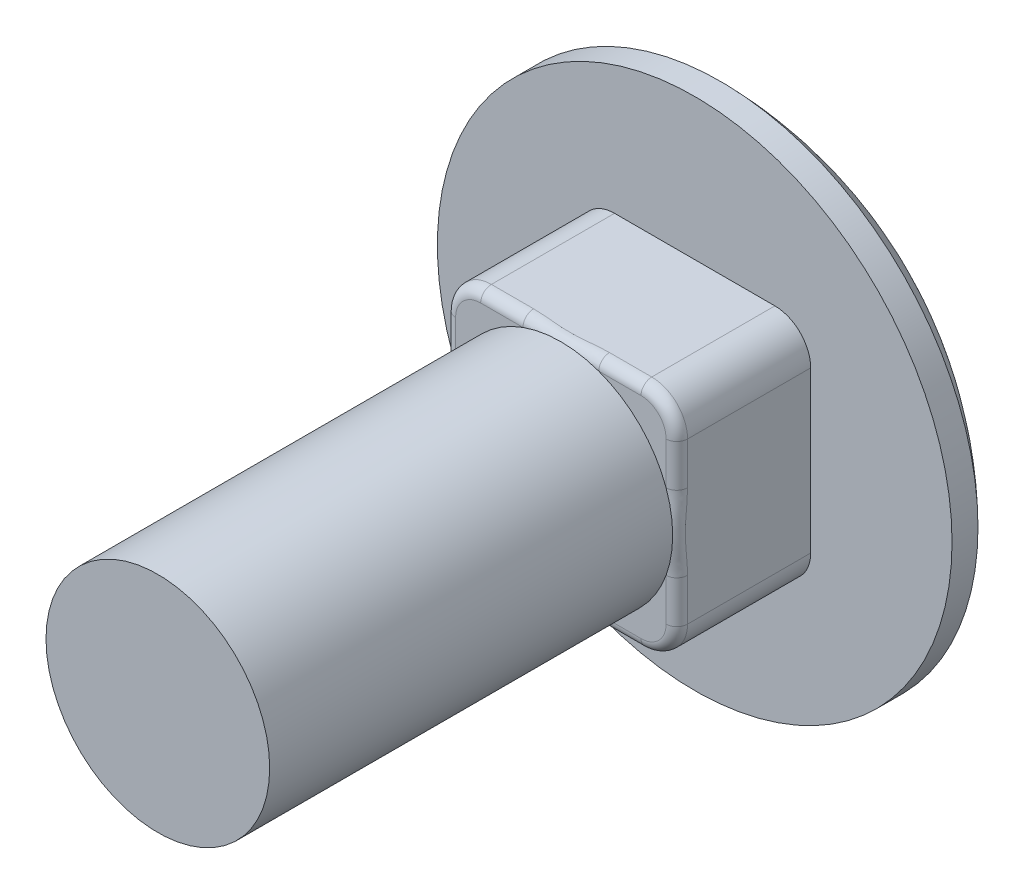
SolidWorks part; units mm, degrees
ref_plane "Front Plane" through (0, 0, 0) normal (0, 0, 1) x (1, 0, 0)
ref_plane "Top Plane" through (0, 0, 0) normal (0, 1, 0) x (1, 0, 0)
ref_plane "Right Plane" through (0, 0, 0) normal (1, 0, 0) x (0, 0, -1)
sketch "Sketch1" plane through (0, 0, 0) normal (1, 0, 0) x (0, 0, -1)
  line L0 (0, 0) -> (4.4704, 0)
  line L1 (0, 9.1313) -> (0.9207, 9.1313)
  line L2 (0, 0) -> (0, 9.1313)
  line L3 (0, 0) -> (15.0876, 0) construction
  arc A0 (0.9207, 9.1313) -> (4.4704, 0) centre (-8.2256, 0.3202) cw
  dimension "HeadRadius" = 12.7
  dimension "Head Height" = 4.4704
  dimension "Head dia/2" = 9.1313
  dimension "1/4ofHeight" = 0.9207
revolve "Revolve1" add sketch "Sketch1" angle 360 about L3
sketch "Sketch2" plane through (0, 0, 0) normal (0, 0, 1) x (1, 0, 0)
  line L0 (0, 0) -> (4.1148, 4.1148) construction
  line L1 (-4.1148, 4.1148) -> (4.1148, 4.1148)
  line L2 (-4.1148, 4.1148) -> (-4.1148, -4.1148)
  line L3 (-4.1148, -4.1148) -> (4.1148, -4.1148)
  line L4 (4.1148, 4.1148) -> (4.1148, -4.1148)
  dimension "D1" = 45
  dimension "Neck Width" = 8.2296
  dimension "NeckWidth/2" = 4.1148
extrude "Extrude1" add sketch "Sketch2" along normal blind 4.7498
sketch "Sketch3" plane through (0, 0, 4.7498) normal (0, 0, 1) x (1, 0, 0)
  circle A0 centre (0, 0) radius 3.9688
  dimension "Thread" = 7.9375
extrude "Extrude2" add sketch "Sketch3" along normal blind 14.3002
fillet "Fillet1" radius 1.27 4 edges at (-4.1148, 4.1148, 2.3749) (-4.1148, -4.1148, 2.3749) (4.1148, -4.1148, 2.3749) (4.1148, 4.1148, 2.3749)
fillet "Fillet2" radius 0.381 8 edges at (4.1148, 0, 4.7498) (3.7428, -3.7428, 4.7498) (0, -4.1148, 4.7498) (-3.7428, -3.7428, 4.7498) (-4.1148, 0, 4.7498) (-3.7428, 3.7428, 4.7498) (0, 4.1148, 4.7498) (3.7428, 3.7428, 4.7498)
